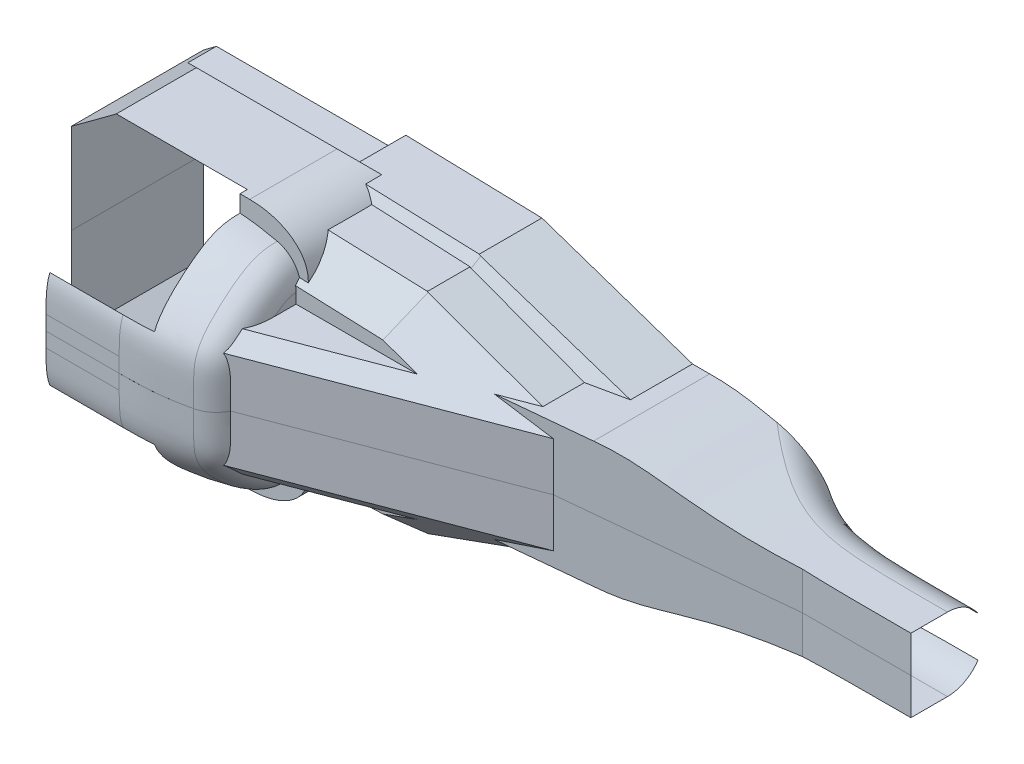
SolidWorks part; units mm, degrees
ref_plane "Piano frontale" through (0, 0, 0) normal (0, 0, 1) x (1, 0, 0)
ref_plane "Piano superiore" through (0, 0, 0) normal (0, 1, 0) x (1, 0, 0)
ref_plane "Piano destro" through (0, 0, 0) normal (1, 0, 0) x (0, 0, -1)
imported_body "Superficie-Importato1"
imported_body "Superficie-Importato2"
mirror "Specchia1" about plane through (0, 0, 0) normal (0, 1, 0)
